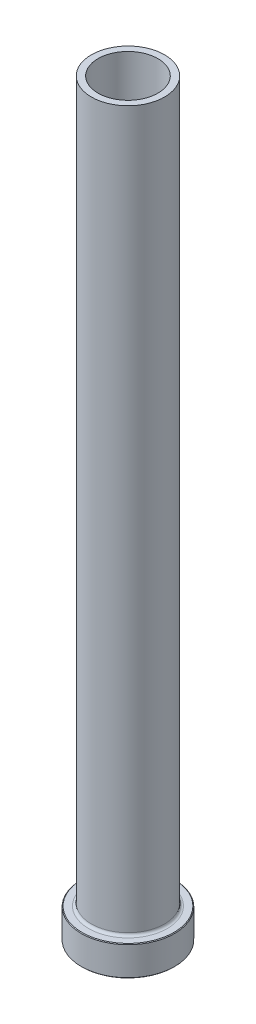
SolidWorks part; units mm, degrees
ref_plane "Front Plane" through (0, 0, 0) normal (0, 0, 1) x (1, 0, 0)
ref_plane "Top Plane" through (0, 0, 0) normal (0, 1, 0) x (1, 0, 0)
ref_plane "Right Plane" through (0, 0, 0) normal (1, 0, 0) x (0, 0, -1)
sketch "Sketch1" plane through (0, 0, 0) normal (0, 0, 1) x (1, 0, 0)
  line L0 (-9, 225) -> (-11, 225)
  line L1 (-11, 225) -> (-11, 9)
  line L2 (-11, 9) -> (-14, 9)
  line L3 (-14, 9) -> (-14, 0)
  line L4 (15.4, 0) -> (-15.4, 0) construction
  line L5 (-14, 0) -> (-9.25, 0)
  line L6 (-9, 170) -> (-9, 225)
  line L7 (0, 92.1877) -> (0, -15.5353) construction
  line L8 (0, -15.4) -> (0, 15.4) construction
  line L9 (-9, 170) -> (-9.25, 158)
  line L10 (-9.25, 158) -> (-9.25, 0)
  dimension "D1" = 0.25
  dimension "ID" = 18
  dimension "OD" = 22
  dimension "L" = 225
  dimension "H" = 28
  dimension "T" = 9
  dimension "N" = 55
  dimension "D2" = 12
revolve "Revolve1" add sketch "Sketch1" angle 360 about L7
fillet "Fillet1" radius 0.8 1 edges at (0, 9, 11)
chamfer "Chamfer1" distance 0.2 angle 45 2 edges at (0, 9, 14) (0, 0, 14)
chamfer "Chamfer3" distance 0.5 angle 45 1 edges at (0, 0, 9.25)
